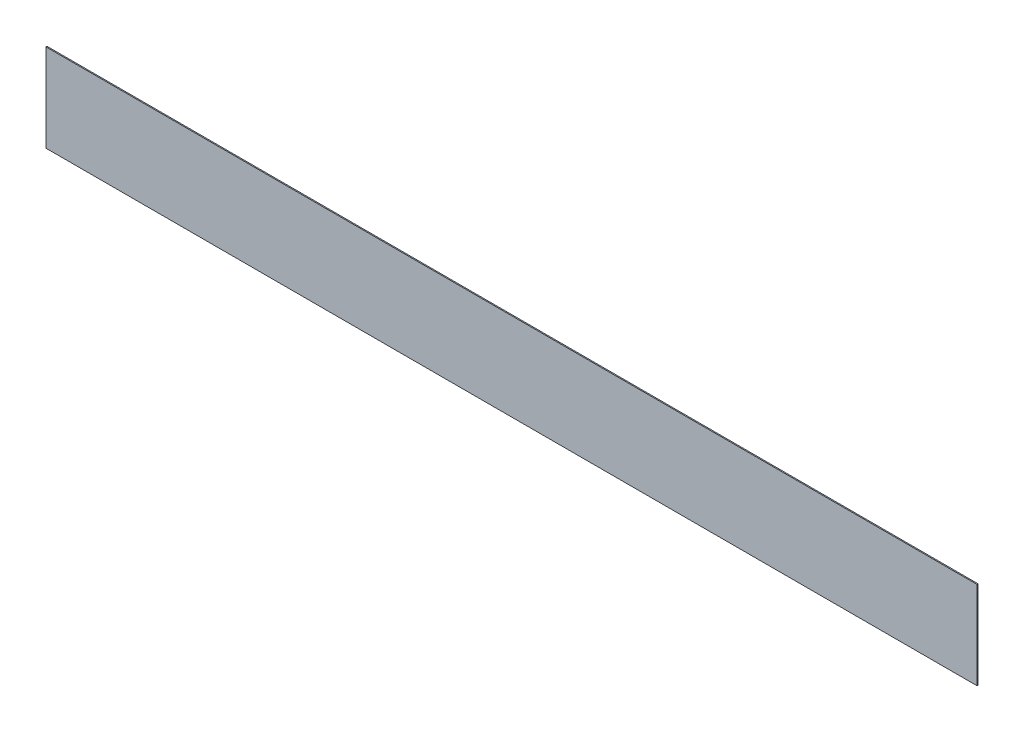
SolidWorks part; units mm, degrees
ref_plane "Plan de face" through (0, 0, 0) normal (0, 0, 1) x (1, 0, 0)
ref_plane "Plan de dessus" through (0, 0, 0) normal (0, 1, 0) x (1, 0, 0)
ref_plane "Plan de droite" through (0, 0, 0) normal (1, 0, 0) x (0, 0, -1)
sketch "Esquisse1" plane through (0, 0, 0) normal (0, 0, 1) x (1, 0, 0)
  line L1 (-118.1311, 38.8524) -> (1631.8689, 38.8524)
  line L2 (-118.1311, 38.8524) -> (-118.1311, -126.1476)
  line L3 (-118.1311, -126.1476) -> (1631.8689, -126.1476)
  line L4 (1631.8689, 38.8524) -> (1631.8689, -126.1476)
  dimension "D1" = 1750
  dimension "D2" = 165
extrude "Boss.-Extru.1" add sketch "Esquisse1" along normal blind 2
